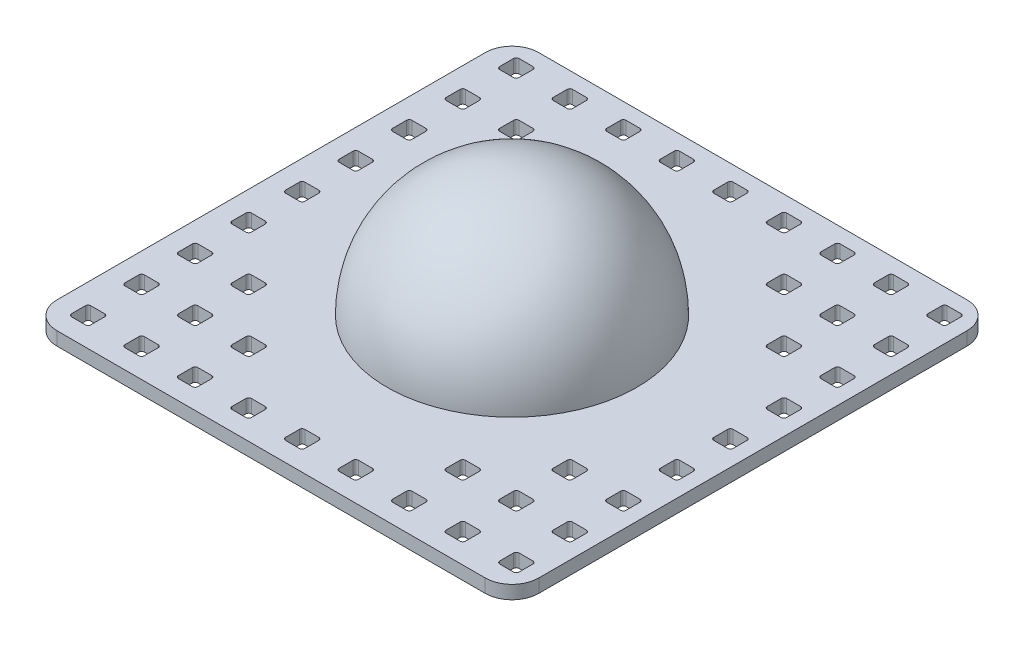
SolidWorks part; units mm, degrees
ref_plane "Front Plane" through (0, 0, 0) normal (0, 0, 1) x (1, 0, 0)
ref_plane "Top Plane" through (0, 0, 0) normal (0, 1, 0) x (1, 0, 0)
ref_plane "Right Plane" through (0, 0, 0) normal (1, 0, 0) x (0, 0, -1)
sketch "Sketch1" plane through (0, 0, 0) normal (0, 1, 0) x (1, 0, 0)
  line L0 (0, 29.6333) -> (0, -29.6333)
  arc A0 (0, -29.6333) -> (0, 29.6333) centre (0, 0) ccw
  dimension "D1" = 59.2667
revolve "Revolve3" add sketch "Sketch1" angle 360 about L0
sketch "Sketch2" plane through (0, 0, 0) normal (0, 1, 0) x (1, 0, 0)
  line L0 (-29.6333, -29.6333) -> (29.6333, -29.6333)
  line L1 (-29.6333, -29.6333) -> (-29.6333, 29.6333)
  line L2 (29.6333, -29.6333) -> (29.6333, 29.6333)
  line L3 (-29.6333, 29.6333) -> (29.6333, 29.6333)
  line L4 (-29.6333, -29.6333) -> (29.6333, 29.6333) construction
  line L5 (29.6333, -29.6333) -> (-29.6333, 29.6333) construction
  circle A0 centre (0, 0) radius 29.6333 construction
  point P1 (0, 0)
extrude "Cut-Extrude1" cut sketch "Sketch2" against normal through all
sketch "Sketch3" plane through (0, 0, 0) normal (0, 1, 0) x (1, 0, 0)
  line L1 (-57.15, 57.15) -> (57.15, 57.15)
  line L2 (-57.15, 57.15) -> (-57.15, -57.15)
  line L3 (-57.15, -57.15) -> (57.15, -57.15)
  line L4 (57.15, 57.15) -> (57.15, -57.15)
  line L5 (-57.15, 57.15) -> (57.15, -57.15) construction
  line L6 (-57.15, -57.15) -> (57.15, 57.15) construction
  point P0 (0, 0)
  dimension "D1" = 114.3
extrude "Boss-Extrude1" add sketch "Sketch3" against normal blind 3.175
sketch "Sketch4"
  dimension "D4" = 0.635
  dimension "D1" = 4.572
  dimension "D2" = 4.572
  dimension "D3" = 4.572
extrude "Cut-Extrude2" cut sketch "Sketch4" against normal through all
sketch "Sketch6" plane through (0, -3.175, 0) normal (0, -1, 0) x (-1, 0, 0)
  line L0 (0, 23.2833) -> (0, -23.2833)
  arc A0 (0, 23.2833) -> (0, -23.2833) centre (0, 0) ccw
  point P4 (0, 0)
  dimension "D1" = 46.5667
revolve "Cut-Revolve5" cut sketch "Sketch6" angle 360 about L0
fillet "Fillet1" radius 6.35 4 edges at (57.15, -1.5875, 57.15) (57.15, -1.5875, -57.15) (-57.15, -1.5875, -57.15) (-57.15, -1.5875, 57.15)
